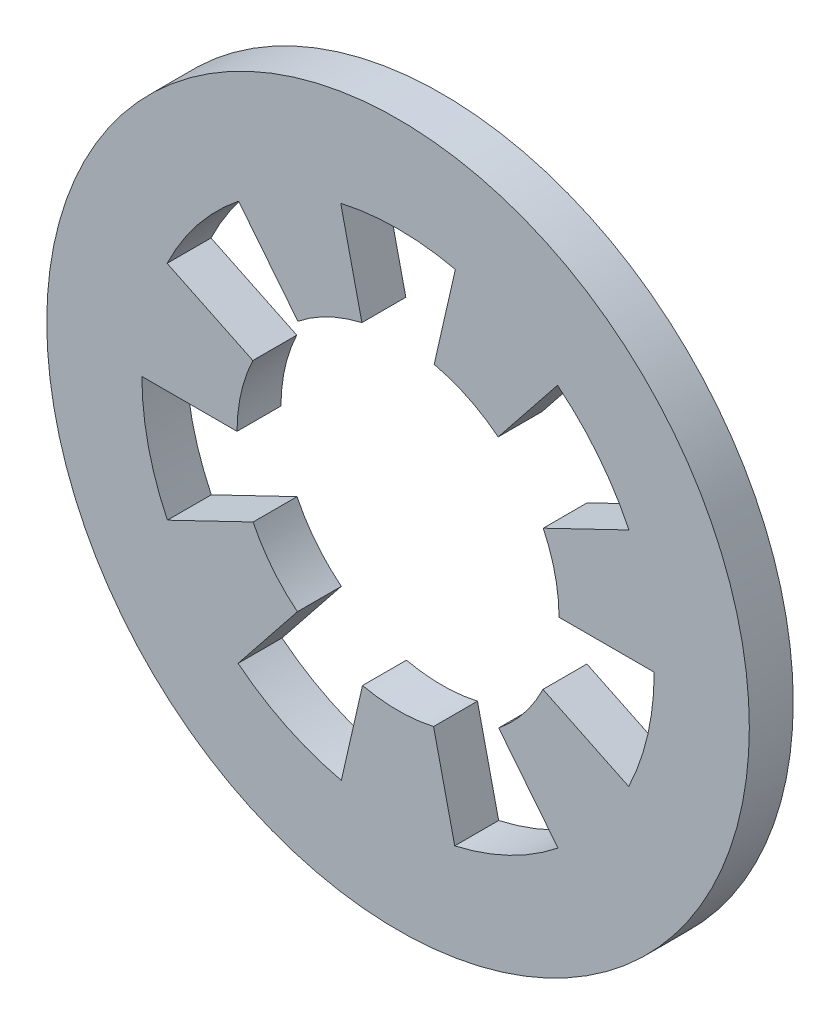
SolidWorks part; units mm, degrees
ref_plane "Front Plane" through (0, 0, 0) normal (0, 0, 1) x (1, 0, 0)
ref_plane "Top Plane" through (0, 0, 0) normal (0, 1, 0) x (1, 0, 0)
ref_plane "Right Plane" through (0, 0, 0) normal (1, 0, 0) x (0, 0, -1)
sketch "BodySke" plane through (0, 0, 0) normal (0, 1, 0) x (1, 0, 0)
  line L0 (0, 0) -> (0, 7) construction
  line L2 (1.1, 0) -> (2.4, 0)
  line L3 (1.1, 0) -> (1.1, 0.3)
  line L4 (1.1, 0.3) -> (2.4, 0.3)
  line L5 (2.4, 0) -> (2.4, 0.3)
  dimension "Inner_dia" = 2.2
  dimension "Outer_dia" = 4.8
  dimension "Thickness" = 0.3
  dimension "Num_tooth" = 7
revolve "BaseBody" add sketch "BodySke" angle 360 about L0
sketch "ToothSke" plane through (0, 0, 0) normal (0, 0, 1) x (1, 0, 0)
  line L0 (0, 0) -> (0, 2.7341) construction
  line L2 (-0.3915, 1.7057) -> (-0.2468, 1.0719)
  line L3 (-0.2468, 1.0719) -> (0.2468, 1.0719)
  line L4 (0.3915, 1.7057) -> (0.2468, 1.0719)
  circle A0 centre (0, 0) radius 1.75 construction
  arc A1 (-0.3915, 1.7057) -> (0.3915, 1.7057) centre (0, 0) cw
  circle A2 centre (0, 0) radius 1.1 construction
  circle A3 centre (0, 0) radius 1.1 construction
  point P11 (0, 1.0719)
  point P12 (0, 1.75)
  dimension "D1" = 3.5
  dimension "D2" = 0.4937
  dimension "D3" = 25.714
extrude "ToothCut" cut sketch "ToothSke" against normal through all
pattern_circular "ToothPat" count 7 over 360 about axis through (0, 0, 0) along (0, 0, 1) of "ToothCut"
equation "\"D1@ToothSke\" =  ( \"Inner_dia@BodySke\" + \"Outer_dia@BodySke\" )  / 2"
equation "\"D2@ToothSke\" =  pi  * \"Inner_dia@BodySke\" / 2 / \"Num_tooth@BodySke\""
equation "\"D3@ToothSke\" = 180 / \"Num_tooth@BodySke\""
equation "\"Num_tooth@ToothPat\" = \"Num_tooth@BodySke\""
